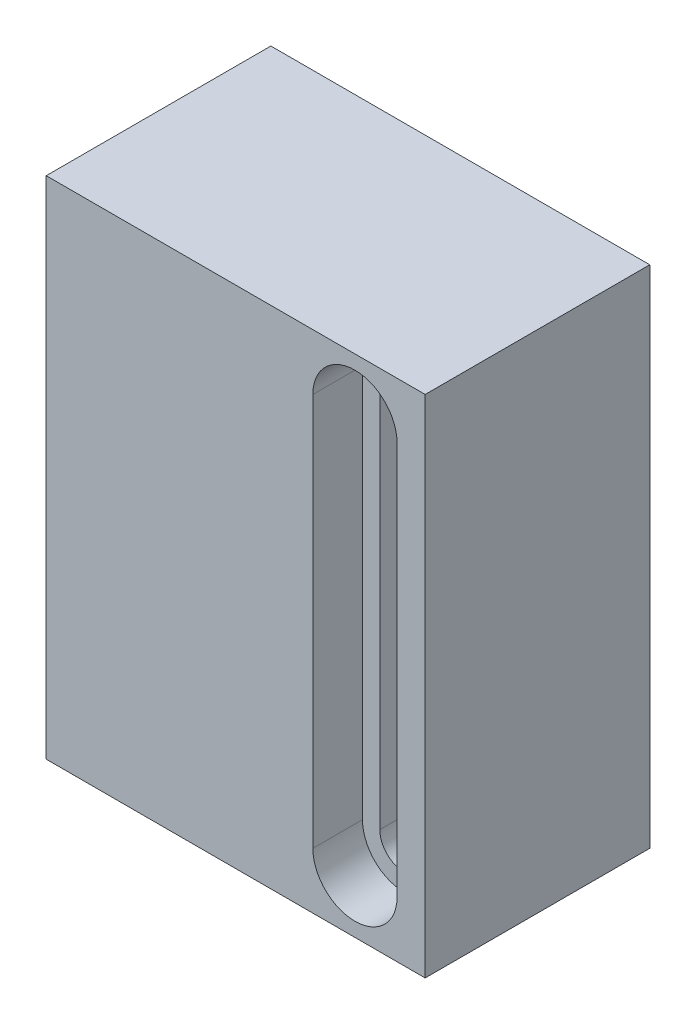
SolidWorks part; units mm, degrees
ref_plane "Front Plane" through (0, 0, 0) normal (0, 0, 1) x (1, 0, 0)
ref_plane "Top Plane" through (0, 0, 0) normal (0, 1, 0) x (1, 0, 0)
ref_plane "Right Plane" through (0, 0, 0) normal (1, 0, 0) x (0, 0, -1)
sketch "Sketch1" plane through (0, 0, 0) normal (0, 1, 0) x (1, 0, 0)
  line L1 (-21.4249, -12.7) -> (21.4249, -12.7)
  line L2 (-21.4249, -12.7) -> (-21.4249, 12.7)
  line L3 (-21.4249, 12.7) -> (21.4249, 12.7)
  line L4 (21.4249, -12.7) -> (21.4249, 12.7)
  line L5 (-21.4249, -12.7) -> (21.4249, 12.7) construction
  line L6 (-21.4249, 12.7) -> (21.4249, -12.7) construction
  point P0 (0, 0)
  dimension "D1" = 25.4
  dimension "D2" = 42.8498
extrude "Boss-Extrude1" add sketch "Sketch1" along normal blind 57.15
sketch "Sketch2" plane through (0, 0, 12.7) normal (0, 0, 1) x (1, 0, 0)
  line L0 (-21.4249, 28.575) -> (49978.5751, 28.575) construction
  line L1 (8.7249, 6.35) -> (18.2499, 6.35) construction
  line L2 (8.7249, 6.35) -> (8.7249, 50.8)
  line L3 (8.7249, 50.8) -> (18.2499, 50.8) construction
  line L4 (18.2499, 6.35) -> (18.2499, 50.8)
  line L5 (-21.4249, 57.15) -> (-21.4249, 0) construction
  line L6 (-21.4249, 0) -> (21.4249, 0) construction
  line L7 (21.4249, 57.15) -> (21.4249, 0) construction
  arc A0 (8.7249, 50.8) -> (18.2499, 50.8) centre (13.4874, 50.8) cw
  arc A1 (18.2499, 6.35) -> (8.7249, 6.35) centre (13.4874, 6.35) cw
  point P8 (-21.4249, 28.575)
  dimension "D1" = 50.8
  dimension "D2" = 9.525
  dimension "D3" = 6.35
  dimension "D4" = 7.9375
extrude "Cut-Extrude1" cut sketch "Sketch2" against normal blind 5.6134
sketch "Sketch3" plane through (0, 0, -12.7) normal (0, 0, -1) x (-1, 0, 0)
  line L0 (-8.7249, 6.35) -> (-8.7249, 50.8) construction
  line L1 (-18.2499, 6.35) -> (-18.2499, 50.8) construction
  line L2 (-8.7249, 6.35) -> (-8.7249, 50.8)
  line L3 (-18.2499, 6.35) -> (-18.2499, 50.8)
  arc A0 (-8.7249, 50.8) -> (-18.2499, 50.8) centre (-13.4874, 50.8) ccw construction
  arc A1 (-18.2499, 6.35) -> (-8.7249, 6.35) centre (-13.4874, 6.35) ccw construction
  arc A2 (-8.7249, 50.8) -> (-18.2499, 50.8) centre (-13.4874, 50.8) ccw
  arc A3 (-18.2499, 6.35) -> (-8.7249, 6.35) centre (-13.4874, 6.35) ccw
extrude "Cut-Extrude2" cut sketch "Sketch3" against normal blind 5.6134
sketch "Sketch4" plane through (0, 0, 7.0866) normal (0, 0, 1) x (1, 0, 0)
  line L0 (13.4874, 6.35) -> (13.4874, 50006.35) construction
  line L1 (18.2499, 28.575) -> (50018.2499, 28.575) construction
  line L2 (18.2499, 6.35) -> (18.2499, 50.8) construction
  line L4 (10.6807, 6.35) -> (16.2941, 6.35) construction
  line L5 (10.6807, 6.35) -> (10.6807, 50.8)
  line L6 (10.6807, 50.8) -> (16.2941, 50.8) construction
  line L7 (16.2941, 6.35) -> (16.2941, 50.8)
  line L8 (10.6807, 6.35) -> (16.2941, 50.8) construction
  line L9 (10.6807, 50.8) -> (16.2941, 6.35) construction
  arc A0 (10.6807, 50.8) -> (16.2941, 50.8) centre (13.4874, 50.8) cw
  arc A1 (16.2941, 6.35) -> (10.6807, 6.35) centre (13.4874, 6.35) cw
  arc A2 (8.7249, 6.35) -> (18.2499, 6.35) centre (13.4874, 6.35) ccw construction
  point P7 (18.2499, 28.575)
  point P8 (13.4874, 28.575)
  dimension "D1" = 5.6134
extrude "Cut-Extrude3" cut sketch "Sketch4" against normal through all
